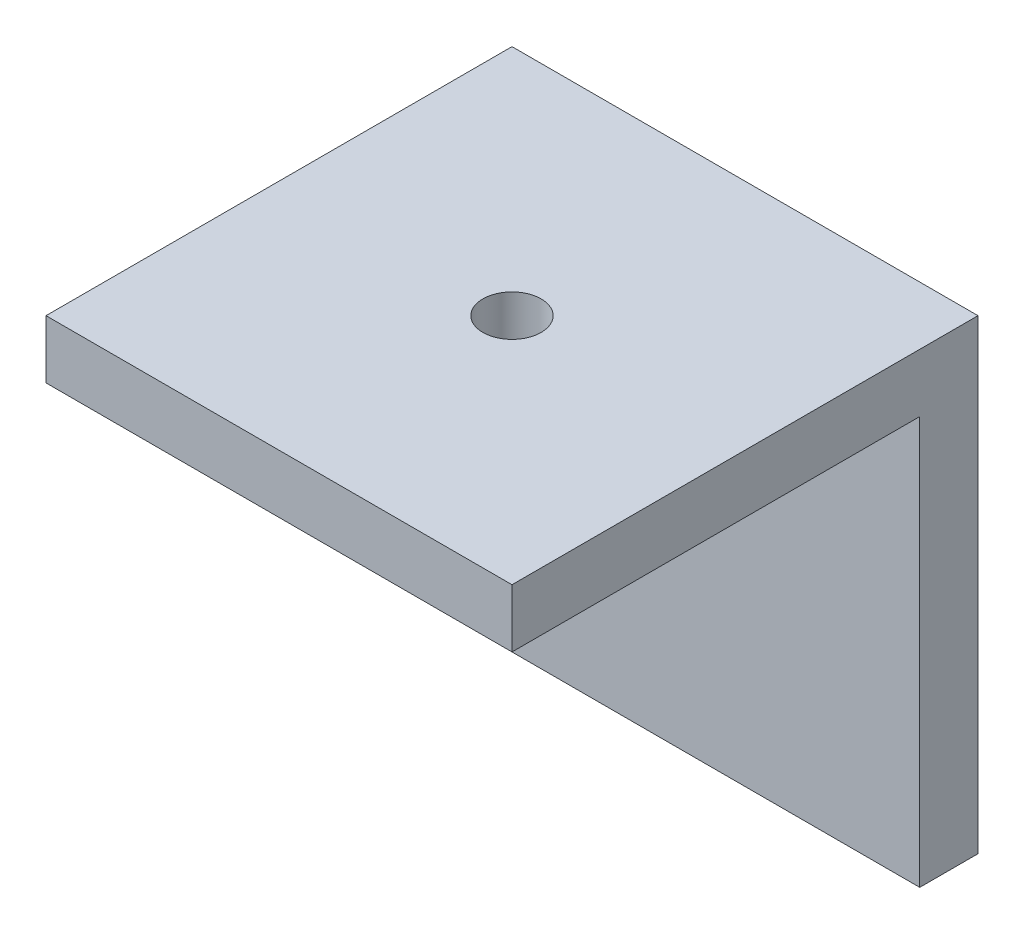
SolidWorks part; units mm, degrees
ref_plane "Front" through (0, 0, 0) normal (0, 0, 1) x (1, 0, 0)
ref_plane "Top" through (0, 0, 0) normal (0, 1, 0) x (1, 0, 0)
ref_plane "Right" through (0, 0, 0) normal (1, 0, 0) x (0, 0, -1)
sketch "스케치2" plane through (0, 0, 0) normal (0, 0, 1) x (1, 0, 0)
  line L1 (12.7, -12.7) -> (-12.7, -12.7)
  line L2 (12.7, -12.7) -> (12.7, 12.7)
  line L3 (12.7, 12.7) -> (-12.7, 12.7)
  line L4 (-12.7, -12.7) -> (-12.7, 12.7)
  line L5 (0, 12.7) -> (0, -12.7) construction
  line L6 (12.7, 0) -> (-12.7, 0) construction
  circle A0 centre (0, 0) radius 1.5875
  point P0 (0, 0)
  dimension "D3" = 3.175
  dimension "D1" = 25.4
  dimension "D2" = 25.4
extrude "보스-돌출1" add sketch "스케치2" along normal blind 3.175
sketch "스케치3" plane through (0, 0, 3.175) normal (0, 0, 1) x (1, 0, 0)
  line L0 (12.7, -12.7) -> (12.7, 12.7) construction
  line L1 (-12.7, 12.7) -> (12.7, 12.7)
  line L2 (-12.7, 12.7) -> (-12.7, 9.525)
  line L3 (-12.7, 9.525) -> (12.7, 9.525)
  line L4 (12.7, 12.7) -> (12.7, 9.525)
  dimension "D1" = 3.175
extrude "보스-돌출2" add sketch "스케치3" along normal blind 22.225
sketch "스케치4" plane through (0, 12.7, 0) normal (0, 1, 0) x (1, 0, 0)
  line L0 (12.7, -25.4) -> (-12.7, -25.4) construction
  line L2 (-12.7, -25.4) -> (-12.7, 0) construction
  circle A0 centre (0, -12.7) radius 1.5875
  point P4 (0, 0)
  point P6 (-12.7, -10.7237)
  dimension "D1" = 12.7
  dimension "D3" = 3.175
  dimension "D2" = 12.7
extrude "컷-돌출1" cut sketch "스케치4" against normal blind 22.225
